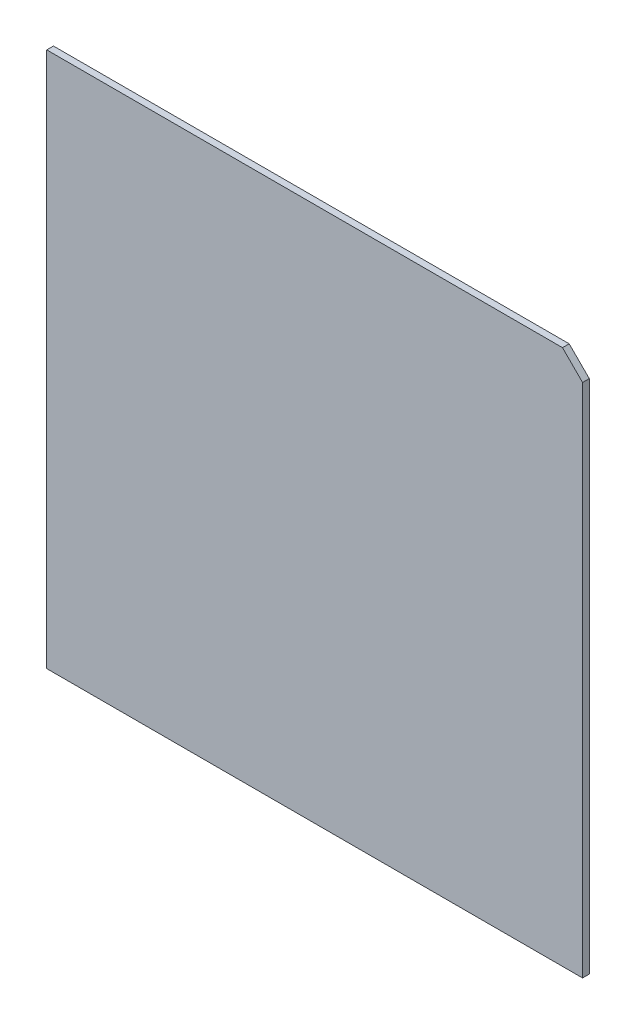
SolidWorks part; units mm, degrees
ref_plane "Front Plane" through (0, 0, 0) normal (0, 0, 1) x (1, 0, 0)
ref_plane "Top Plane" through (0, 0, 0) normal (0, 1, 0) x (1, 0, 0)
ref_plane "Right Plane" through (0, 0, 0) normal (1, 0, 0) x (0, 0, -1)
sketch "Sketch2" plane through (0, 0, 0) normal (0, 0, 1) x (1, 0, 0)
  line L1 (-1000, 1000) -> (1000, 1000)
  line L2 (-1000, 1000) -> (-1000, -1000)
  line L3 (-1000, -1000) -> (1000, -1000)
  line L4 (1000, 1000) -> (1000, -1000)
  dimension "D1" = 2000
  dimension "D2" = 2000
  dimension "D3" = 1000
  dimension "D4" = 1000
extrude "Boss-Extrude2" add sketch "Sketch2" along normal blind 25
sketch "Sketch3" plane through (0, 0, 25) normal (0, 0, 1) x (1, 0, 0)
  line L0 (925, 1000) -> (1000, 925)
  line L1 (1000, 1000) -> (-1000, 1000) construction
  line L2 (1000, -1000) -> (1000, 1000) construction
  line L3 (1000, 925) -> (1000, 1000)
  line L4 (1000, 1000) -> (925, 1000)
  dimension "D1" = 75
  dimension "D2" = 75
extrude "Cut-Extrude1" cut sketch "Sketch3" against normal blind 25
